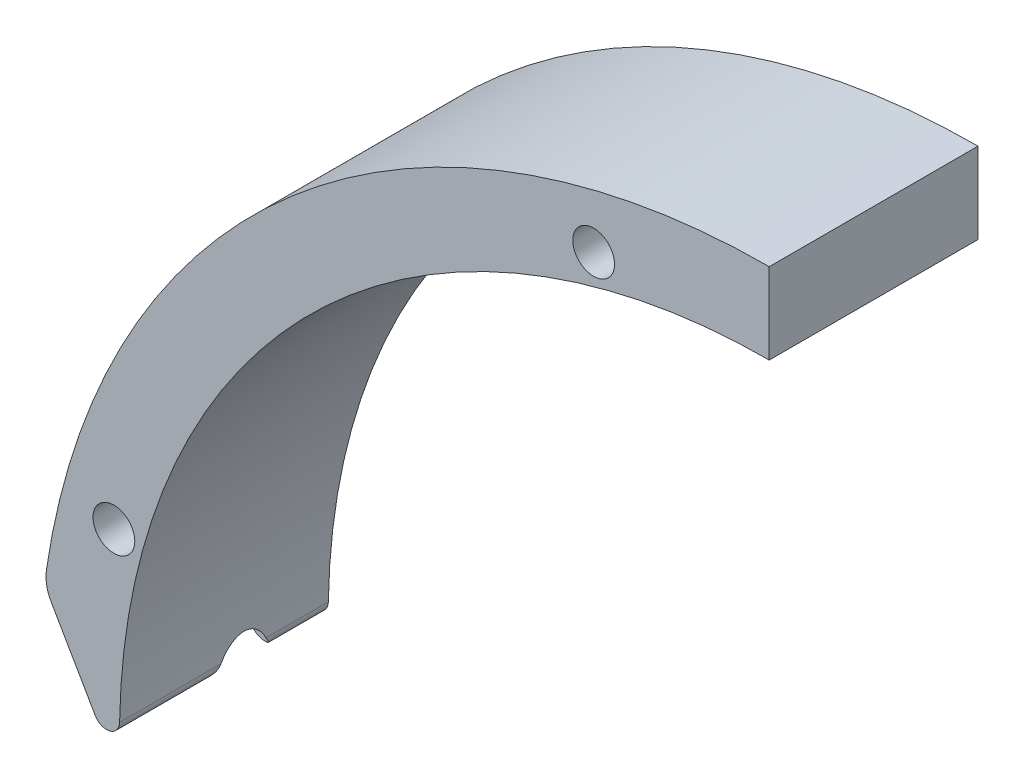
SolidWorks part; units mm, degrees
ref_plane "Vorne" through (0, 0, 0) normal (0, 0, 1) x (1, 0, 0)
ref_plane "Oben" through (0, 0, 0) normal (0, 1, 0) x (1, 0, 0)
ref_plane "Rechts" through (0, 0, 0) normal (1, 0, 0) x (0, 0, -1)
sketch "Skizze1" plane through (0, 0, 0) normal (0, 0, 1) x (1, 0, 0)
  line L0 (-56, 0) -> (-49.8, 0)
  line L1 (0, 56) -> (0, 49.8)
  arc A0 (0, 49.8) -> (-49.8, 0) centre (0, 0) ccw
  arc A1 (0, 56) -> (-56, 0) centre (0, 0) ccw
  dimension "D1" = 49.8
  dimension "D2" = 56
  dimension "D3" = 90
extrude "Linear austragen1" add sketch "Skizze1" along normal blind 16
hole_wizard "Ø3.2 (3.2) Durchmesser Bohrung1" positions "Skizze3" profile "Skizze2" hole size "Ø3.2" standard "ISO"
sketch "Skizze3" plane through (0, 0, 16) normal (0, 0, 1) x (1, 0, 0)
  line L0 (0, 0) -> (-50.2281, 13.4586) construction
  line L2 (0, 0) -> (-13.4586, 50.2281) construction
  line L4 (-56, 0) -> (-49.8, 0) construction
  line L6 (0, 49.8) -> (0, 56) construction
  arc A0 (-13.4586, 50.2281) -> (-50.2281, 13.4586) centre (0, 0) ccw construction
  point P0 (-13.4586, 50.2281)
  point P1 (-50.2281, 13.4586)
  dimension "D3" = 52
  dimension "D1" = 15
  dimension "D2" = 15
sketch "Skizze2" plane through (-13.4586, 50.2281, 16) normal (1, 0, 0) x (0, -1, 0)
  line L0 (0, 0) -> (0, 16)
  line L1 (0, 16) -> (1.6, 16)
  line L2 (1.6, 16) -> (1.6, 0)
  line L5 (1.6, 0) -> (0, 0)
  line L11 (0, -6.35) -> (0, 107.95) construction
  dimension "Bohrerdurchmesser" = 3.2
  dimension "Bohrungstiefe" = 16
ref_plane "Ebene1" through (0, 0, 0) normal (0.5, -0.866, 0) x (0, 0, -1)
sketch "Skizze9" plane through (0, 0, 0) normal (0, 0, -1) x (-1, 0, 0)
  line L0 (49.7096, -3) -> (55.9196, -3)
  line L1 (56, 0) -> (49.8, 0) construction
  line L2 (56, 0) -> (49.8, 0)
  arc A0 (49.8, 0) -> (49.7096, -3) centre (0, 0) cw
  arc A1 (55.9196, -3) -> (56, 0) centre (0, 0) ccw
  arc A2 (56, 0) -> (0, 56) centre (0, 0) ccw construction
  arc A3 (49.8, 0) -> (0, 49.8) centre (0, 0) ccw construction
  dimension "D1" = 3
extrude "Linear austragen5" add sketch "Skizze9" against normal blind 16
sketch "Skizze6" plane through (0, 0, 0) normal (0.5, -0.866, 0) x (0, 0, -1)
  line L1 (4.254, -44.5497) -> (-17.8032, -44.5497)
  line L2 (4.254, -44.5497) -> (4.254, -52.3628)
  line L3 (4.254, -52.3628) -> (-17.8032, -52.3628)
  line L4 (-17.8032, -44.5497) -> (-17.8032, -52.3628)
  line L5 (-16, -44.5497) -> (0, -44.5497) construction
extrude "Linear austragen4" cut sketch "Skizze6" against normal through all
sketch "Skizze5" plane through (0, 0, 0) normal (0.5, -0.866, 0) x (0, 0, -1)
  line L0 (-16, 24.9) -> (-16, -44.5497) construction
  line L2 (-4, -44.5) -> (-4, -56.5)
  line L3 (-4, -56.5) -> (-9, -56.5)
  line L4 (-9, -56.5) -> (-9, -44.5)
  arc A0 (-4, -44.5) -> (-9, -44.5) centre (-6.5, -44.5) ccw
  dimension "D1" = 9.5
  dimension "D2" = 5
  dimension "D3" = 12
  dimension "D4" = 44.5
extrude "Linear austragen3" cut sketch "Skizze5" against normal through all
fillet "Verrundung5" radius 1 2 edges at (-49.7096, -3, 12.5) (-49.7096, -3, 2)
fillet "Verrundung6" radius 3 2 edges at (-55.5468, 7.1103, 12.5) (-55.5468, 7.1103, 2)
